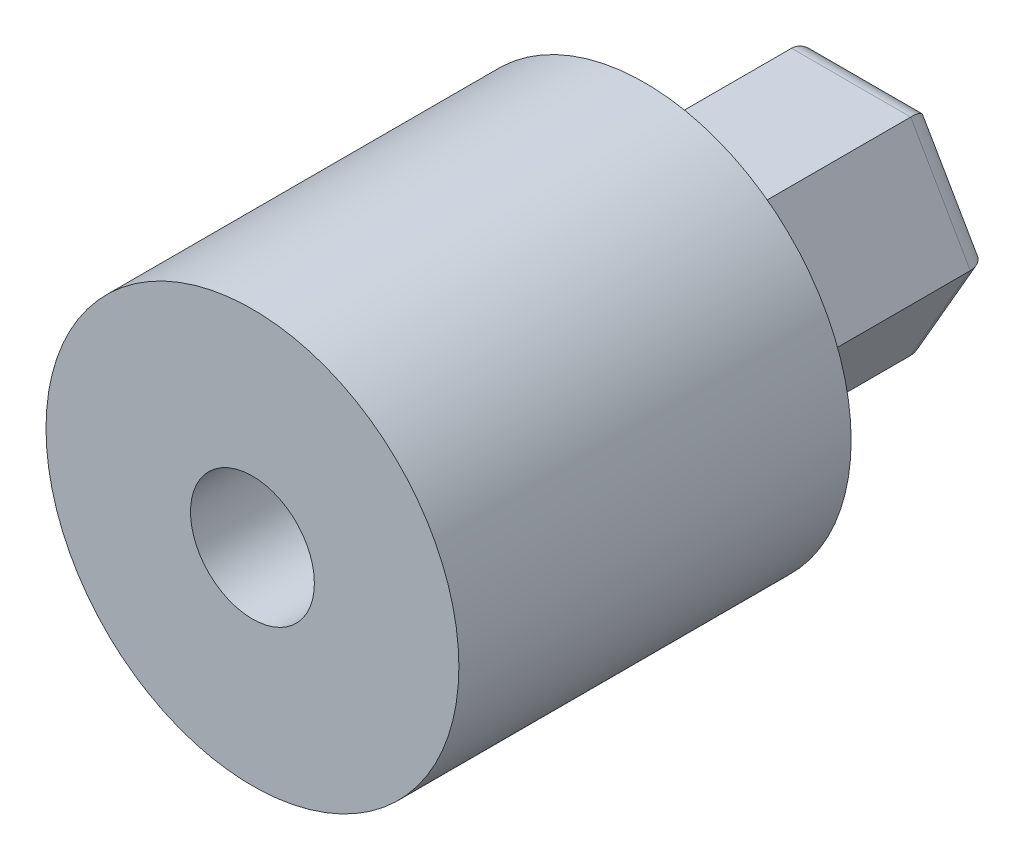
SolidWorks part; units mm, degrees
ref_plane "Alzado" through (0, 0, 0) normal (0, 0, 1) x (1, 0, 0)
ref_plane "Planta" through (0, 0, 0) normal (0, 1, 0) x (1, 0, 0)
ref_plane "Vista lateral" through (0, 0, 0) normal (1, 0, 0) x (0, 0, -1)
sketch "Croquis1" plane through (0, 0, 0) normal (0, 0, 1) x (1, 0, 0)
  line L1 (-1.4434, 2.5) -> (-2.8868, 0)
  line L2 (-2.8868, 0) -> (-1.4434, -2.5)
  line L3 (-1.4434, -2.5) -> (1.4434, -2.5)
  line L4 (1.4434, -2.5) -> (2.8868, 0)
  line L5 (2.8868, 0) -> (1.4434, 2.5)
  line L6 (1.4434, 2.5) -> (-1.4434, 2.5)
  circle A0 centre (0, 0) radius 2.5 construction
  dimension "D1" = 5
extrude "Saliente-Extruir1" add sketch "Croquis1" along normal blind 15
sketch "Croquis2" plane through (0, 0, 0) normal (0, 0, -1) x (-1, 0, 0)
  circle A0 centre (0, 0) radius 1.6
  dimension "D1" = 3.2
extrude "Cortar-Extruir1" cut sketch "Croquis2" against normal blind 2
sketch "Croquis3" plane through (0, 0, 15) normal (0, 0, 1) x (1, 0, 0)
  circle A0 centre (0, 0) radius 1.5
  dimension "D1" = 3
extrude "Cortar-Extruir2" cut sketch "Croquis3" against normal blind 6
fillet "Redondeo1" radius 0.5 6 edges at (2.1651, -1.25, 0) (2.1651, 1.25, 0) (0, 2.5, 0) (-2.1651, 1.25, 0) (-2.1651, -1.25, 0) (0, -2.5, 0)
sketch "Croquis4" plane through (0, 0, 15) normal (0, 0, 1) x (1, 0, 0)
  circle A0 centre (0, 0) radius 1.5
  circle A1 centre (0, 0) radius 5
  circle A2 centre (0, 0) radius 1.5 construction
  dimension "D1" = 10
extrude "Saliente-Extruir2" add sketch "Croquis4" against normal blind 9.5
